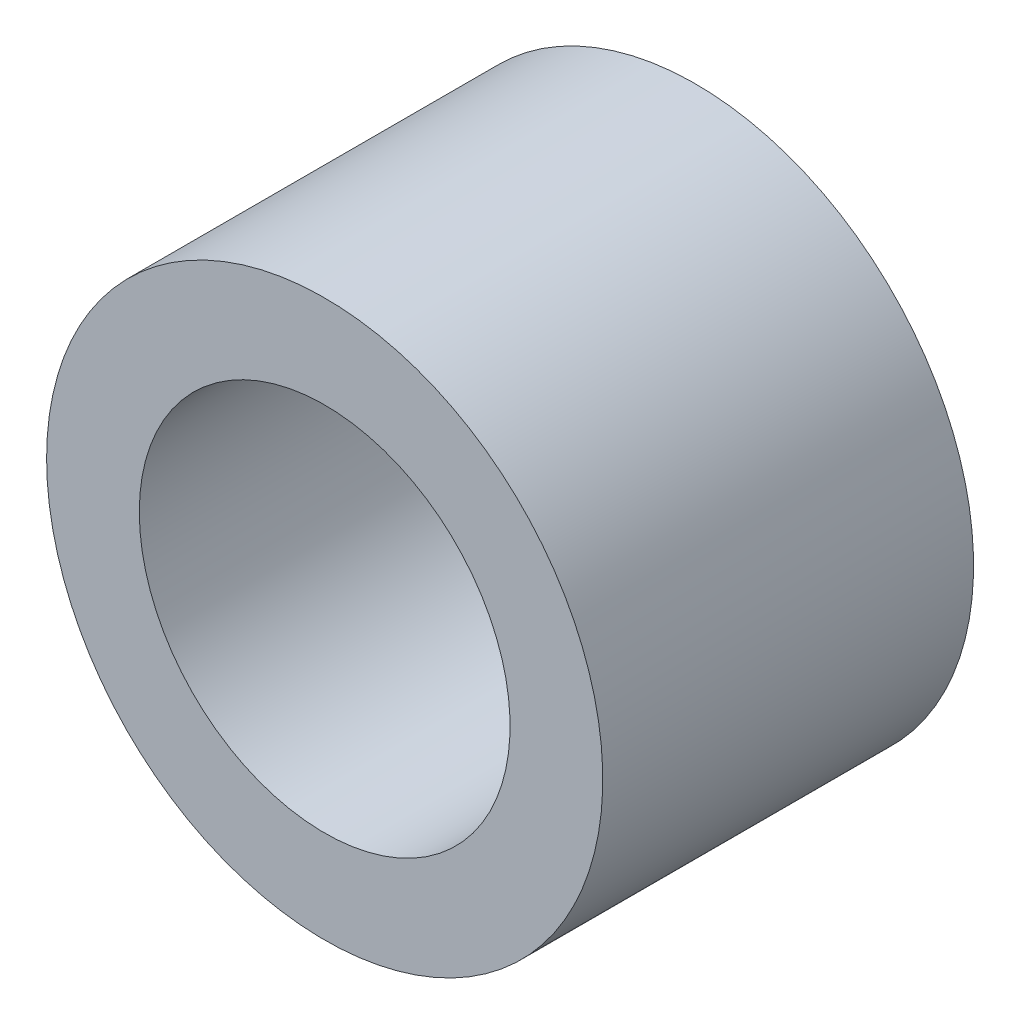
SolidWorks part; units mm, degrees
ref_plane "Face" through (0, 0, 0) normal (0, 0, 1) x (1, 0, 0)
ref_plane "Dessus" through (0, 0, 0) normal (0, 1, 0) x (1, 0, 0)
ref_plane "Droite" through (0, 0, 0) normal (1, 0, 0) x (0, 0, -1)
sketch "Esquisse1" plane through (0, 0, 0) normal (0, 0, 1) x (1, 0, 0)
  circle A0 centre (0, 0) radius 9
  circle A1 centre (0, 0) radius 6
  dimension "D1" = 18
  dimension "D2" = 12
extrude "Base-Extrusion" add sketch "Esquisse1" along normal blind 12
